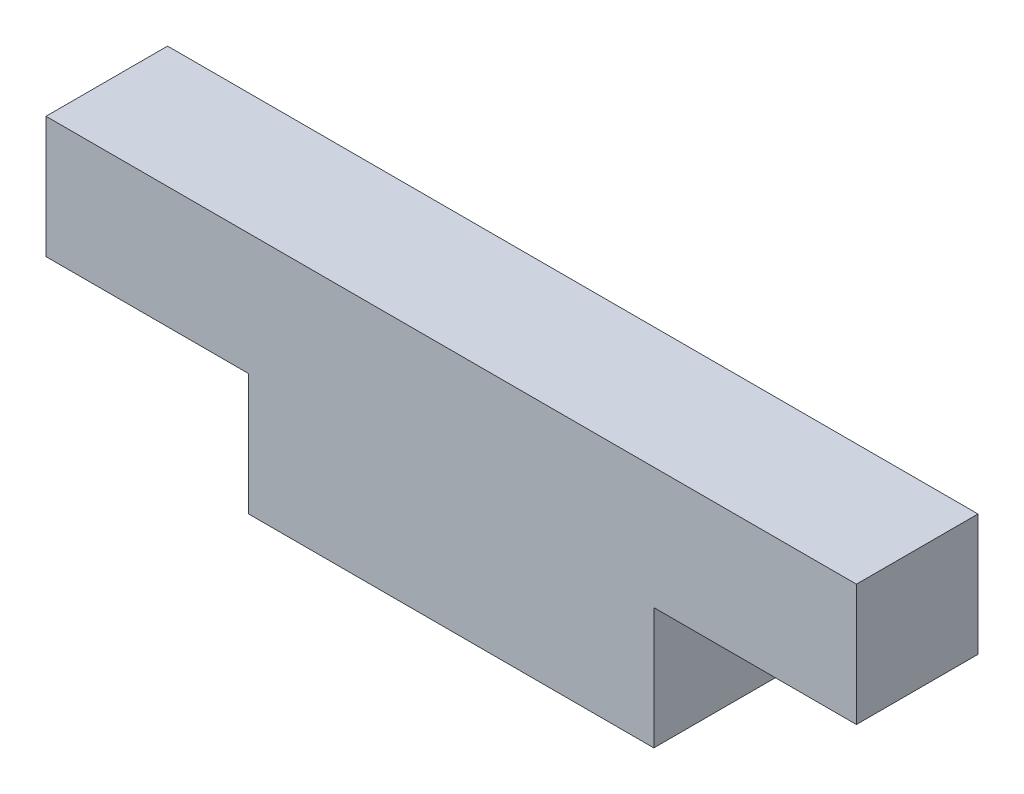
SolidWorks part; units mm, degrees
ref_plane "Plan de face" through (0, 0, 0) normal (0, 0, 1) x (1, 0, 0)
ref_plane "Plan de dessus" through (0, 0, 0) normal (0, 1, 0) x (1, 0, 0)
ref_plane "Plan de droite" through (0, 0, 0) normal (1, 0, 0) x (0, 0, -1)
sketch "Esquisse1" plane through (0, 0, 0) normal (0, 0, 1) x (1, 0, 0)
  line L0 (0, 0) -> (0, 6)
  line L1 (0, 0) -> (-5, 0)
  line L2 (-5, 0) -> (-5, 3)
  line L3 (-5, 3) -> (-10, 3)
  line L4 (-10, 3) -> (-10, 6)
  line L5 (-10, 6) -> (0, 6)
  dimension "D1" = 5
  dimension "D2" = 3
  dimension "D3" = 3
  dimension "D4" = 5
extrude "Boss.-Extru.1" add sketch "Esquisse1" along normal blind 3
mirror "Symétrie1" about plane through (0, 0, 3) normal (-1, 0, 0) of "Boss.-Extru.1"
